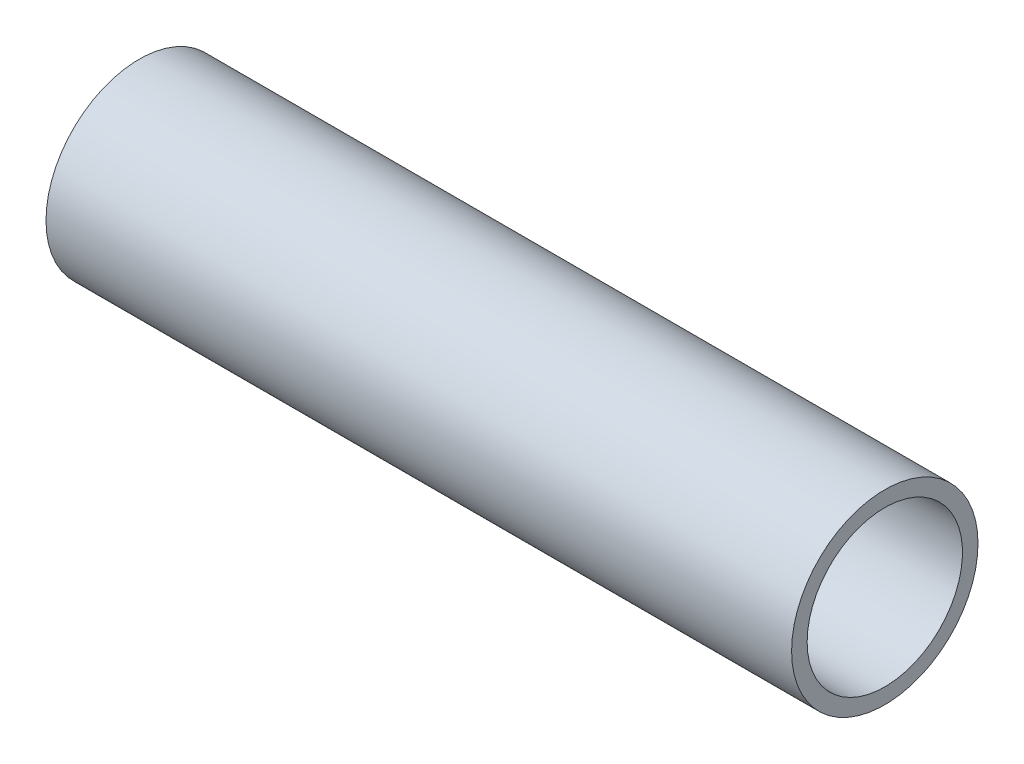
SolidWorks part; units mm, degrees
ref_plane "Piano frontale" through (0, 0, 0) normal (0, 0, 1) x (1, 0, 0)
ref_plane "Piano superiore" through (0, 0, 0) normal (0, 1, 0) x (1, 0, 0)
ref_plane "Piano destro" through (0, 0, 0) normal (1, 0, 0) x (0, 0, -1)
sketch "Schizzo1" plane through (0, 0, 0) normal (0, 0, 1) x (1, 0, 0)
  line L0 (-25.572, 0) -> (33.9161, 0) construction
  line L1 (-18.3802, 5) -> (-18.3802, 6)
  line L2 (-18.3802, 6) -> (29.6198, 6)
  line L3 (29.6198, 6) -> (29.6198, 5)
  line L4 (29.6198, 5) -> (-18.3802, 5)
  dimension "D1" = 6
  dimension "D2" = 48
  dimension "D3" = 5
revolve "Rivoluzione1" add sketch "Schizzo1" angle 360 about L0
